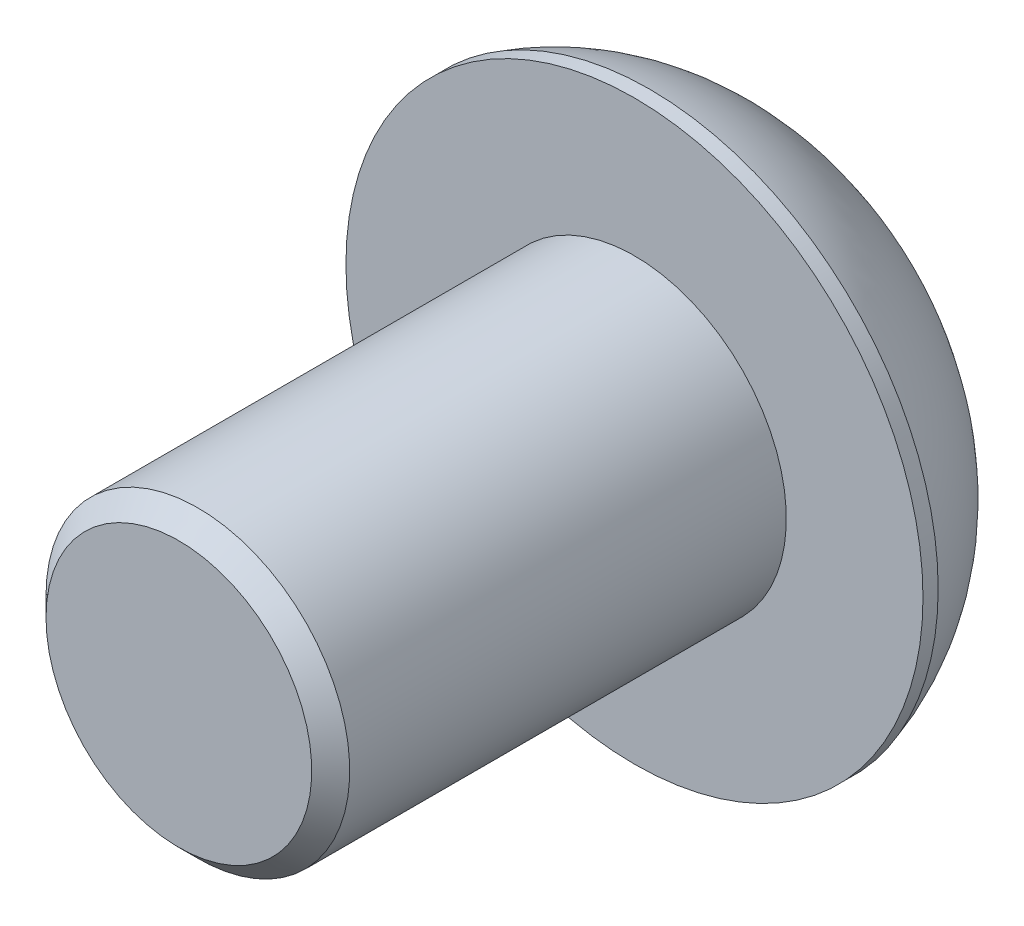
SolidWorks part; units mm, degrees
ref_plane "Front Plane" through (0, 0, 0) normal (0, 0, 1) x (1, 0, 0)
ref_plane "Top Plane" through (0, 0, 0) normal (0, 1, 0) x (1, 0, 0)
ref_plane "Right Plane" through (0, 0, 0) normal (1, 0, 0) x (0, 0, -1)
sketch "Sketch1" plane through (0, 0, 0) normal (0, 1, 0) x (1, 0, 0)
  line L0 (1.9, 2.2) -> (0, 2.2)
  line L1 (0, -6) -> (1.75, -6)
  line L2 (0, 0) -> (5.1073, 0) construction
  line L3 (2, 0) -> (2, -5.75)
  line L4 (3.8, 0) -> (2, 0)
  line L5 (0, 0) -> (0, -6) construction
  line L6 (2, -5.75) -> (1.75, -6)
  line L7 (0, 2.2) -> (0, -6)
  line L9 (3.8, 0) -> (3.8, 0.2)
  arc A0 (3.8, 0.2) -> (1.9, 2.2) centre (0.9185, -0.6349) ccw
  dimension "D2" = 3
  dimension "D1" = 2
  dimension "D5" = 2.2
  dimension "D4" = 0.2
  dimension "D3" = 3.8
  dimension "D6" = 1.9
  dimension "D7" = 45
  dimension "D8" = 0.25
revolve "Revolve1" add sketch "Sketch1" angle 360 about L5
sketch "Sketch2" plane through (0, 0, -2.2) normal (0, 0, -1) x (-1, 0, 0)
  line L1 (1.4434, 0) -> (0.7217, 1.25)
  line L2 (0.7217, 1.25) -> (-0.7217, 1.25)
  line L3 (-0.7217, 1.25) -> (-1.4434, 0)
  line L4 (-1.4434, 0) -> (-0.7217, -1.25)
  line L5 (-0.7217, -1.25) -> (0.7217, -1.25)
  line L6 (0.7217, -1.25) -> (1.4434, 0)
  circle A0 centre (0, 0) radius 1.25 construction
  dimension "D1" = 1.25
extrude "Extrude1" cut sketch "Sketch2" against normal blind 1.25
